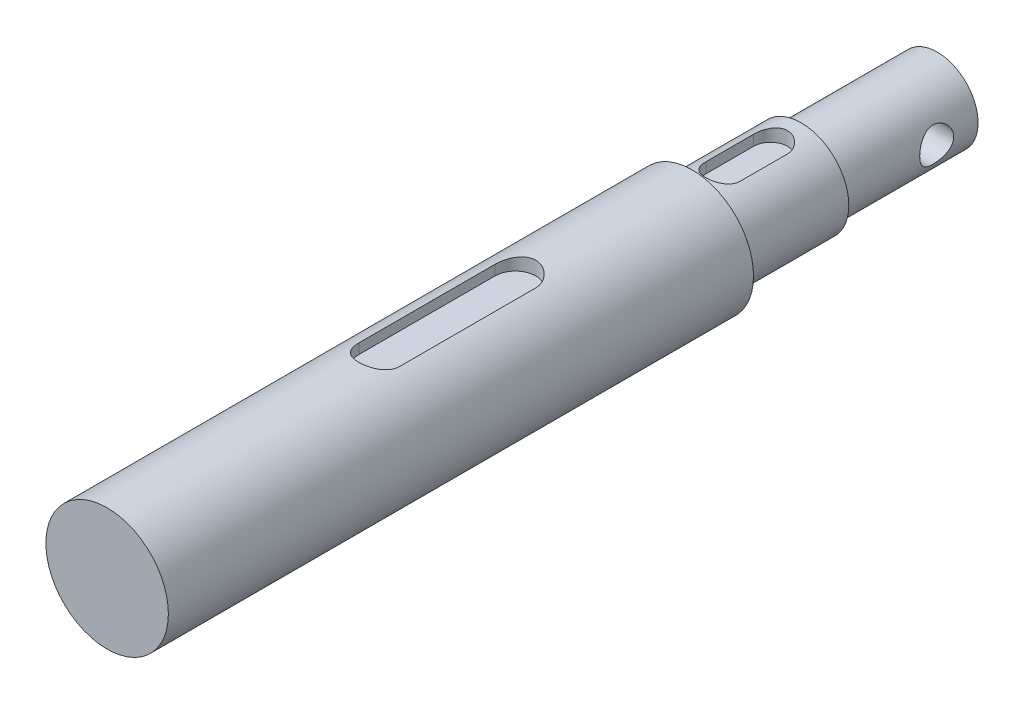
SolidWorks part; units mm, degrees
ref_plane "前视基准面" through (0, 0, 0) normal (0, 0, 1) x (1, 0, 0)
ref_plane "上视基准面" through (0, 0, 0) normal (0, 1, 0) x (1, 0, 0)
ref_plane "右视基准面" through (0, 0, 0) normal (1, 0, 0) x (0, 0, -1)
sketch "草图1" plane through (0, 0, 0) normal (0, 0, 1) x (1, 0, 0)
  circle A0 centre (-4.5, 0) radius 9
  dimension "D1" = 18
extrude "拉伸1" add sketch "草图1" against normal blind 82 and the other way blind 4
sketch "草图2" plane through (0, 0, -82) normal (0, 0, -1) x (-1, 0, 0)
  circle A0 centre (4.5, 0) radius 7
  dimension "D1" = 14
extrude "拉伸2" add sketch "草图2" along normal blind 16
ref_plane "基准面1" through (0, 7, 0) normal (0, 1, 0) x (-1, 0, 0)
sketch "草图3" plane through (0, 7, 0) normal (0, 1, 0) x (-1, 0, 0)
  line L0 (1.5, -36) -> (1.5, -56)
  line L3 (7.5, -56) -> (7.5, -36)
  line L4 (-18.5, -46) -> (-11.7386, -46) construction
  line L5 (-18.5, -28) -> (-18.5, -64) construction
  line L6 (4.5, -64) -> (4.5, -49.3954) construction
  line L7 (0.3969, -64) -> (8.6031, -64) construction
  arc A0 (1.5, -56) -> (7.5, -56) centre (4.5, -56) ccw
  arc A1 (7.5, -36) -> (1.5, -36) centre (4.5, -36) ccw
  dimension "D1" = 20
  dimension "D2" = 6
extrude "切除-拉伸1" cut sketch "草图3" along normal through all
ref_plane "基准面2" through (0, 5, 0) normal (0, 1, 0) x (-1, 0, 0)
sketch "草图4" plane through (0, 5, 0) normal (0, 1, 0) x (-1, 0, 0)
  line L0 (4.5, -98) -> (4.5, -78.4705) construction
  line L1 (-2.5, -98) -> (11.5, -98) construction
  line L2 (4.5, -86.5) -> (4.5, -93.5) construction
  line L3 (2, -86.5) -> (2, -93.5)
  line L4 (7, -86.5) -> (7, -93.5)
  line L5 (-2.5, -90) -> (-8.5272, -90) construction
  line L6 (-2.5, -82) -> (-2.5, -98) construction
  arc A0 (2, -86.5) -> (7, -86.5) centre (4.5, -86.5) cw
  arc A1 (2, -93.5) -> (7, -93.5) centre (4.5, -93.5) ccw
  dimension "D3" = 12
  dimension "D1" = 2.5
  dimension "D2" = 2.5
extrude "切除-拉伸2" cut sketch "草图4" along normal through all
sketch "草图5" plane through (0, 0, -98) normal (0, 0, -1) x (-1, 0, 0)
  circle A0 centre (4.5, 0) radius 6
  dimension "D1" = 12
extrude "拉伸3" add sketch "草图5" along normal blind 20
sketch "草图6" plane through (0, 0, 0) normal (-1, 0, 0) x (0, 0, 1)
  line L4 (-121.2736, 0) -> (-106.3835, 0) construction
  circle A0 centre (-111.925, 0) radius 2.5
  dimension "D1" = 5
extrude "切除-拉伸3" cut sketch "草图6" against normal through all and the other way through all
